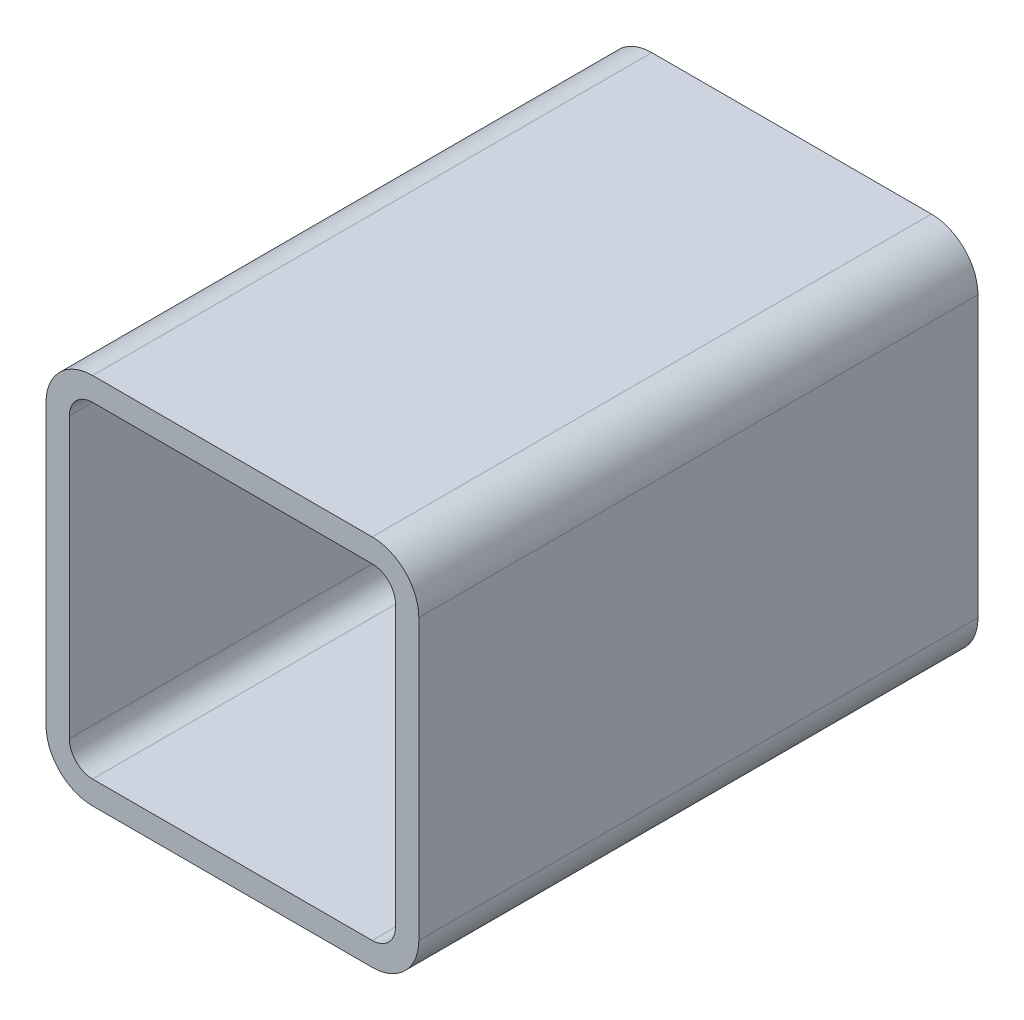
SolidWorks part; units mm, degrees
ref_plane "Front Plane" through (0, 0, 0) normal (0, 0, 1) x (1, 0, 0)
ref_plane "Top Plane" through (0, 0, 0) normal (0, 1, 0) x (1, 0, 0)
ref_plane "Right Plane" through (0, 0, 0) normal (1, 0, 0) x (0, 0, -1)
sketch "Sketch1" plane through (0, 0, 0) normal (0, 0, 1) x (1, 0, 0)
sketch_block_instance "HSS8x8x0.500-1"
sketch_block "HSS8x8x0.500"
extrude "Boss-Extrude1" add sketch "Sketch1" along normal blind 304.8
